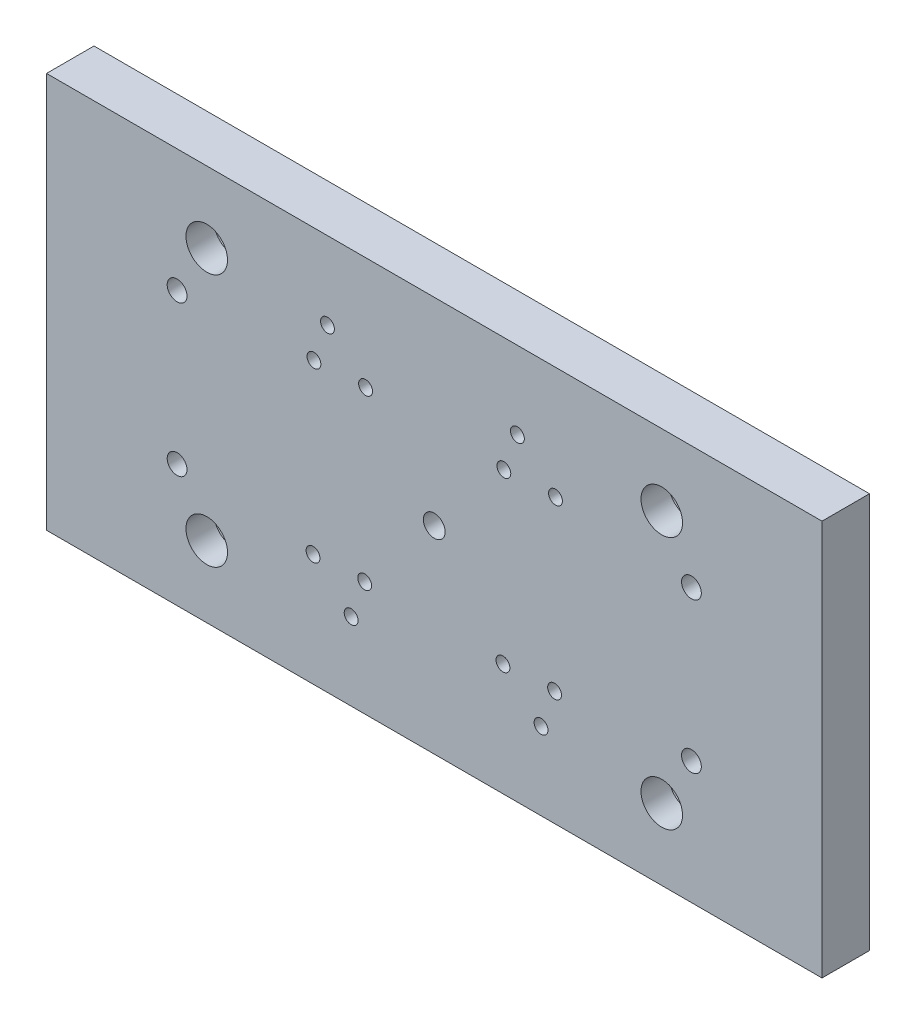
SolidWorks part; units mm, degrees
ref_plane "Face" through (0, 0, 0) normal (0, 0, 1) x (1, 0, 0)
ref_plane "Dessus" through (0, 0, 0) normal (0, 1, 0) x (1, 0, 0)
ref_plane "Droite" through (0, 0, 0) normal (1, 0, 0) x (0, 0, -1)
sketch "Esquisse1" plane through (0, 0, 0) normal (0, 0, 1) x (1, 0, 0)
  line L1 (0, 0) -> (196, 0)
  line L2 (0, 0) -> (0, 100)
  line L3 (0, 100) -> (196, 100)
  line L4 (196, 0) -> (196, 100)
  dimension "D1" = 196
  dimension "D2" = 100
extrude "Extrusion1" add sketch "Esquisse1" along normal blind 12
sketch "Esquisse2" plane through (0, 0, 12) normal (0, 0, 1) x (1, 0, 0)
  line L0 (0, 50) -> (196, 50) construction
  line L1 (0, 100) -> (0, 0) construction
  line L2 (196, 0) -> (196, 100) construction
  line L3 (98, 100) -> (98, 0) construction
  line L4 (196, 100) -> (0, 100) construction
  line L5 (0, 0) -> (196, 0) construction
  circle A0 centre (155.5, 82) radius 5.25
  circle A1 centre (40.5, 82) radius 5.25
  circle A2 centre (40.5, 18) radius 5.25
  circle A3 centre (155.5, 18) radius 5.25
  circle A4 centre (98, 50) radius 2.75
  dimension "D1" = 10.5
  dimension "D5" = 5.5
  dimension "D2" = 32
  dimension "D3" = 57.5
extrude "Enlèv. mat.-Extru.1" cut sketch "Esquisse2" against normal through all
sketch "Esquisse3" plane through (0, 0, 12) normal (0, 0, 1) x (1, 0, 0)
  line L0 (98, 100) -> (98, 0) construction
  line L1 (196, 100) -> (0, 100) construction
  line L2 (0, 0) -> (196, 0) construction
  line L3 (0, 50) -> (196, 50) construction
  line L4 (0, 100) -> (0, 0) construction
  line L5 (196, 0) -> (196, 100) construction
  circle A0 centre (119.01, 80.41) radius 1.75
  circle A1 centre (128.64, 71.58) radius 1.75
  circle A2 centre (115.59, 71.07) radius 1.75
  circle A3 centre (80.64, 71.58) radius 1.75
  circle A4 centre (71.01, 80.41) radius 1.75
  circle A5 centre (67.59, 71.01) radius 1.75
  circle A6 centre (76.99, 19.59) radius 1.75
  circle A7 centre (67.36, 28.42) radius 1.75
  circle A8 centre (80.41, 28.93) radius 1.75
  circle A12 centre (124.99, 19.59) radius 1.75
  circle A13 centre (128.41, 28.99) radius 1.75
  circle A14 centre (115.36, 28.42) radius 1.75
  dimension "D7" = 3.5
  dimension "D8" = 3.5
  dimension "D9" = 3.5
  dimension "D16" = 3.5
  dimension "D17" = 3.5
  dimension "D18" = 3.5
  dimension "D1" = 30.41
  dimension "D2" = 21.58
  dimension "D3" = 21.07
  dimension "D4" = 30.64
  dimension "D5" = 21.01
  dimension "D6" = 17.59
  dimension "D10" = 30.41
  dimension "D11" = 26.99
  dimension "D12" = 17.36
  dimension "D13" = 30.41
  dimension "D14" = 21.58
  dimension "D15" = 21.01
extrude "Enlèv. mat.-Extru.2" cut sketch "Esquisse3" against normal through all
sketch "Esquisse4" plane through (0, 0, 0) normal (0, 0, -1) x (-1, 0, 0)
  circle A4 centre (-98, 50) radius 5.5
extrude "Enlèv. mat.-Extru.3" cut sketch "Esquisse4" against normal blind 3.05
sketch "Esquisse5" plane through (0, 0, 0) normal (0, 0, -1) x (-1, 0, 0)
  circle A12 centre (-124.99, 19.59) radius 3.5
  circle A13 centre (-128.41, 28.99) radius 3.5
  circle A14 centre (-115.36, 28.42) radius 3.5
  circle A15 centre (-80.41, 28.93) radius 3.5
  circle A16 centre (-76.99, 19.59) radius 3.5
  circle A17 centre (-67.36, 28.42) radius 3.5
  circle A18 centre (-67.59, 71.01) radius 3.5
  circle A19 centre (-71.01, 80.41) radius 3.5
  circle A20 centre (-80.64, 71.58) radius 3.5
  circle A21 centre (-128.64, 71.58) radius 3.5
  circle A22 centre (-119.01, 80.41) radius 3.5
  circle A23 centre (-115.59, 71.07) radius 3.5
extrude "Enlèv. mat.-Extru.4" cut sketch "Esquisse5" against normal blind 3.05
sketch "Esquisse6" plane through (0, 0, 0) normal (0, 0, -1) x (-1, 0, 0)
  line L0 (-98, 100) -> (-98, 0) construction
  line L1 (-196, 100) -> (0, 100) construction
  line L2 (0, 0) -> (-196, 0) construction
  line L3 (0, 50) -> (-196, 50) construction
  line L4 (0, 100) -> (0, 0) construction
  line L5 (-196, 0) -> (-196, 100) construction
  circle A1 centre (-155.5, 82) radius 8.5
  circle A2 centre (-40.5, 82) radius 8.5
  circle A3 centre (-40.5, 18) radius 8.5
  circle A4 centre (-155.5, 18) radius 8.5
extrude "Enlèv. mat.-Extru.5" cut sketch "Esquisse6" against normal blind 5
hole_wizard "Trou taraudé M6x1.01" positions "Esquisse8" profile "Esquisse7" tap size "M6x1.0" standard "ISO"
sketch "Esquisse8" plane through (0, 0, 0) normal (0, 0, -1) x (-1, 0, 0)
  line L0 (-196, 50) -> (0, 50) construction
  line L1 (-196, 0) -> (-196, 100) construction
  line L2 (0, 100) -> (0, 0) construction
  line L3 (-98, 100) -> (-98, 0) construction
  line L4 (-196, 100) -> (0, 100) construction
  line L5 (0, 0) -> (-196, 0) construction
  point P0 (-33, 69)
  point P1 (-163, 69)
  point P2 (-163, 31)
  point P3 (-33, 31)
  dimension "D1" = 19
  dimension "D2" = 65
sketch "Esquisse7" plane through (33, 69, 0) normal (1, 0, 0) x (0, 1, 0)
  line L0 (0, 0) -> (0, 12)
  line L1 (0, 12) -> (2.5, 12)
  line L2 (2.5, 12) -> (2.5, 0)
  line L5 (2.5, 0) -> (0, 0)
  line L11 (0, -6.35) -> (0, 107.95) construction
  dimension "Diamètre du trou pour taraudage jusqu'au prochain" = 5
  dimension "Profondeur du trou pour taraudage jusqu'au prochain" = 12
